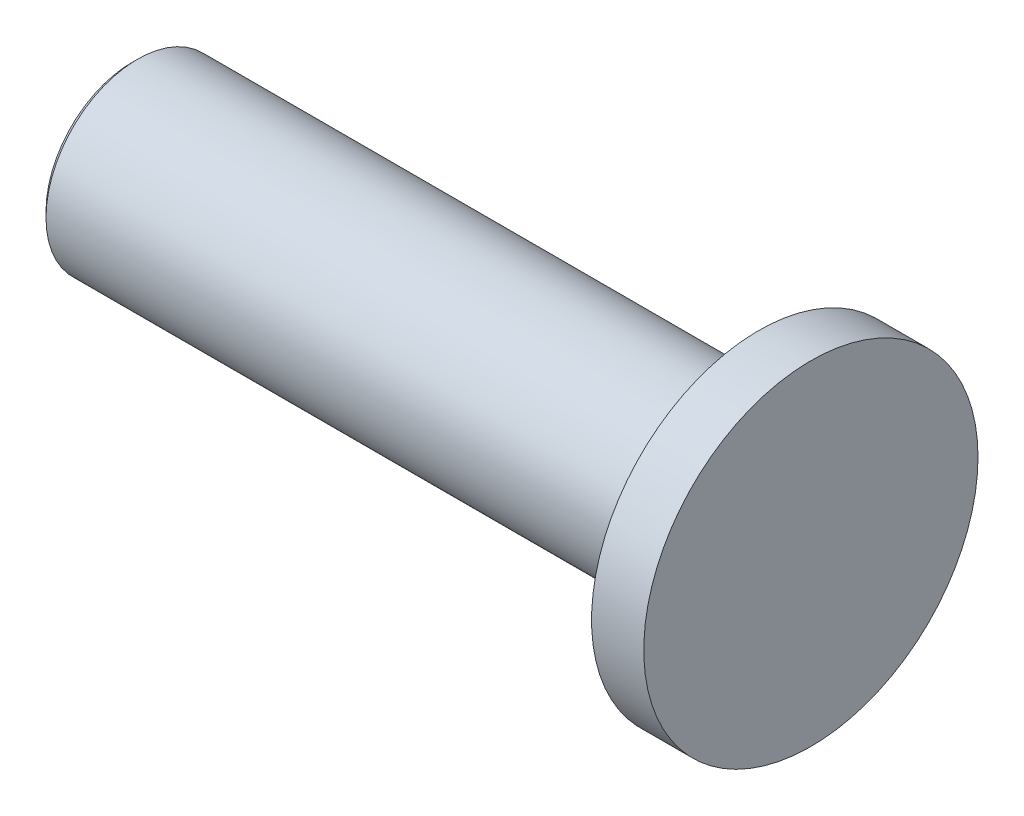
SolidWorks part; units mm, degrees
ref_plane "Front Plane" through (0, 0, 0) normal (0, 0, 1) x (1, 0, 0)
ref_plane "Top Plane" through (0, 0, 0) normal (0, 1, 0) x (1, 0, 0)
ref_plane "Right Plane" through (0, 0, 0) normal (1, 0, 0) x (0, 0, -1)
sketch "Sketch1" plane through (0, 0, 0) normal (0, 0, 1) x (1, 0, 0)
  line L0 (109, 80) -> (109, 0)
  line L1 (109, 0) -> (134, 0)
  line L2 (134, 0) -> (134, 80)
  line L3 (134, 80) -> (109, 80)
  line L4 (109, 0) -> (134, 0) construction
  dimension "D1" = 80
  dimension "D2" = 25
revolve "Revolve1" add sketch "Sketch1" angle 360 about L4
scale "Scale1" scale about centroid uniform scaling yes scale factor 0.75
sketch "Sketch3" plane through (112.125, 0, 0) normal (-1, 0, 0) x (0, 0, 1)
  circle A0 centre (0, 0) radius 32.88
  dimension "D1" = 65.76
extrude "Boss-Extrude2" add sketch "Sketch3" along normal blind 225
chamfer "Chamfer2" distance 2 angle 45 1 edges at (-112.875, 0, 32.88)
